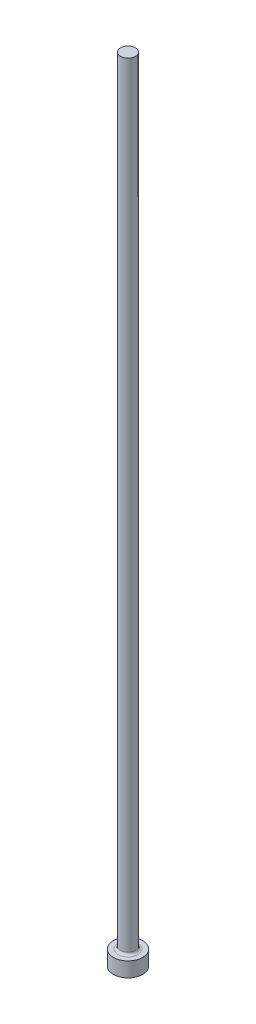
SolidWorks part; units mm, degrees
ref_plane "Front Plane" through (0, 0, 0) normal (0, 0, 1) x (1, 0, 0)
ref_plane "Top Plane" through (0, 0, 0) normal (0, 1, 0) x (1, 0, 0)
ref_plane "Right Plane" through (0, 0, 0) normal (1, 0, 0) x (0, 0, -1)
sketch "Sketch1" plane through (0, 0, 0) normal (0, 0, 1) x (1, 0, 0)
  line L0 (0, 0) -> (4.699, 0)
  line L1 (55, 0) -> (-55, 0) construction
  line L2 (4.699, 0) -> (4.699, 4.7498)
  line L3 (4.699, 4.7498) -> (3.1433, 4.7498)
  line L4 (2.3813, 5.5118) -> (2.3812, 254)
  line L5 (2.3812, 254) -> (0, 254)
  line L6 (0, 254) -> (0, 0)
  arc A0 (3.1433, 4.7498) -> (2.3813, 5.5118) centre (3.1433, 5.5118) cw
  dimension "D5" = 0.762
  dimension "D1" = 2.3813
  dimension "D2" = 4.699
  dimension "D3" = 4.7498
  dimension "D4" = 254
revolve "Revolve1" add sketch "Sketch1" angle 360 about L6
